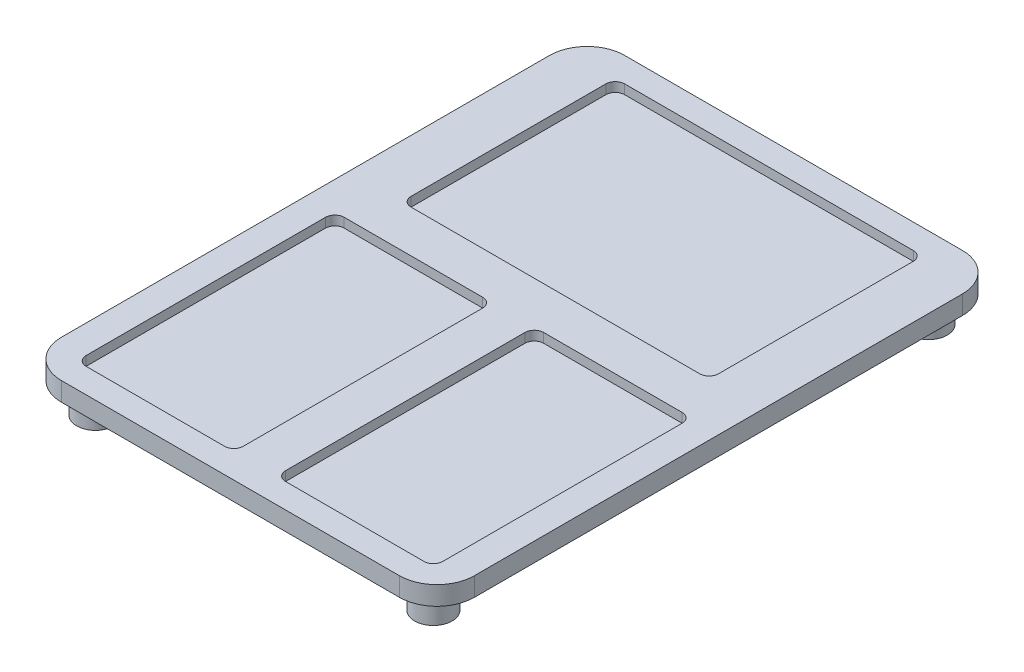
SolidWorks part; units mm, degrees
ref_plane "Front Plane" through (0, 0, 0) normal (0, 0, 1) x (1, 0, 0)
ref_plane "Top Plane" through (0, 0, 0) normal (0, 1, 0) x (1, 0, 0)
ref_plane "Right Plane" through (0, 0, 0) normal (1, 0, 0) x (0, 0, -1)
sketch "Sketch1" plane through (0, 0, 0) normal (0, 1, 0) x (1, 0, 0)
  line L0 (228.6, -381) -> (-228.6, -381)
  line L1 (279.4, -330.2) -> (279.4, 330.2)
  line L2 (-279.4, -330.2) -> (-279.4, 330.2)
  line L3 (228.6, 381) -> (-228.6, 381)
  line L4 (279.4, -381) -> (-279.4, 381) construction
  line L5 (-279.4, -381) -> (279.4, 381) construction
  arc A12 (-279.4, 330.2) -> (-228.6, 381) centre (-228.6, 330.2) cw
  arc A13 (279.4, 330.2) -> (228.6, 381) centre (228.6, 330.2) ccw
  arc A14 (279.4, -330.2) -> (228.6, -381) centre (228.6, -330.2) cw
  arc A15 (-228.6, -381) -> (-279.4, -330.2) centre (-228.6, -330.2) cw
  point P0 (0, 0)
  dimension "D11" = 50.8
  dimension "D1" = 762
  dimension "D2" = 558.8
extrude "Boss-Extrude1" add sketch "Sketch1" along normal blind 25.4
sketch "Sketch2" plane through (0, 25.4, 0) normal (0, 1, 0) x (1, 0, 0)
  line L0 (0, 347.6625) -> (0, -347.6625) construction
  line L1 (-228.6, 1.5875) -> (-41.275, 1.5875)
  line L2 (-241.3, -11.1125) -> (-241.3, -334.9625)
  line L3 (-228.6, -347.6625) -> (-41.275, -347.6625)
  line L4 (-28.575, -11.1125) -> (-28.575, -334.9625)
  line L5 (41.275, 1.5875) -> (228.6, 1.5875)
  line L6 (28.575, -11.1125) -> (28.575, -334.9625)
  line L7 (41.275, -347.6625) -> (228.6, -347.6625)
  line L8 (241.3, -11.1125) -> (241.3, -334.9625)
  line L9 (-195.2625, 58.7375) -> (195.2625, 58.7375)
  line L10 (-207.9625, 71.4375) -> (-207.9625, 334.9625)
  line L11 (-195.2625, 347.6625) -> (195.2625, 347.6625)
  line L12 (207.9625, 71.4375) -> (207.9625, 334.9625)
  line L13 (-28.575, -347.6625) -> (0, -347.6625) construction
  line L14 (-228.6, -334.9625) -> (-41.275, -11.1125) construction
  line L15 (-228.6, -11.1125) -> (-41.275, -334.9625) construction
  line L16 (41.275, -11.1125) -> (228.6, -334.9625) construction
  line L17 (228.6, -11.1125) -> (41.275, -334.9625) construction
  line L18 (-195.2625, 334.9625) -> (195.2625, 71.4375) construction
  line L19 (-195.2625, 71.4375) -> (195.2625, 334.9625) construction
  arc A0 (195.2625, 58.7375) -> (207.9625, 71.4375) centre (195.2625, 71.4375) ccw
  arc A1 (195.2625, 347.6625) -> (207.9625, 334.9625) centre (195.2625, 334.9625) cw
  arc A2 (-207.9625, 334.9625) -> (-195.2625, 347.6625) centre (-195.2625, 334.9625) cw
  arc A3 (-195.2625, 58.7375) -> (-207.9625, 71.4375) centre (-195.2625, 71.4375) cw
  arc A4 (228.6, 1.5875) -> (241.3, -11.1125) centre (228.6, -11.1125) cw
  arc A5 (41.275, 1.5875) -> (28.575, -11.1125) centre (41.275, -11.1125) ccw
  arc A6 (28.575, -334.9625) -> (41.275, -347.6625) centre (41.275, -334.9625) ccw
  arc A7 (228.6, -347.6625) -> (241.3, -334.9625) centre (228.6, -334.9625) ccw
  arc A8 (-241.3, -334.9625) -> (-228.6, -347.6625) centre (-228.6, -334.9625) ccw
  arc A9 (-41.275, 1.5875) -> (-28.575, -11.1125) centre (-41.275, -11.1125) cw
  arc A10 (-41.275, -347.6625) -> (-28.575, -334.9625) centre (-41.275, -334.9625) ccw
  arc A11 (-228.6, 1.5875) -> (-241.3, -11.1125) centre (-228.6, -11.1125) ccw
  point P1 (0, 0)
  point P16 (0, 0)
  point P41 (0, 203.2)
  point P42 (-134.9375, -173.0375)
  point P44 (134.9375, -173.0375)
extrude "Cut-Extrude1" cut sketch "Sketch2" against normal blind 12.7
sketch "Sketch3" plane through (0, 0, 0) normal (0, -1, 0) x (1, 0, 0)
  line L0 (0, -13.97) -> (0, 13.97) construction
  circle A0 centre (-228.6, 334.9625) radius 25.4
  circle A1 centre (-228.6, -334.9625) radius 25.4
  circle A2 centre (228.6, -334.9625) radius 25.4
  circle A3 centre (228.6, 334.9625) radius 25.4
  dimension "D1" = 50.8
  dimension "D2" = 50.8
extrude "Boss-Extrude2" add sketch "Sketch3" along normal blind 38.1
equation "\"D2@Sketch2\"=\"D1@Sketch2\"/2"
equation "\"D7@Sketch2\"=\"D1@Sketch2\""
